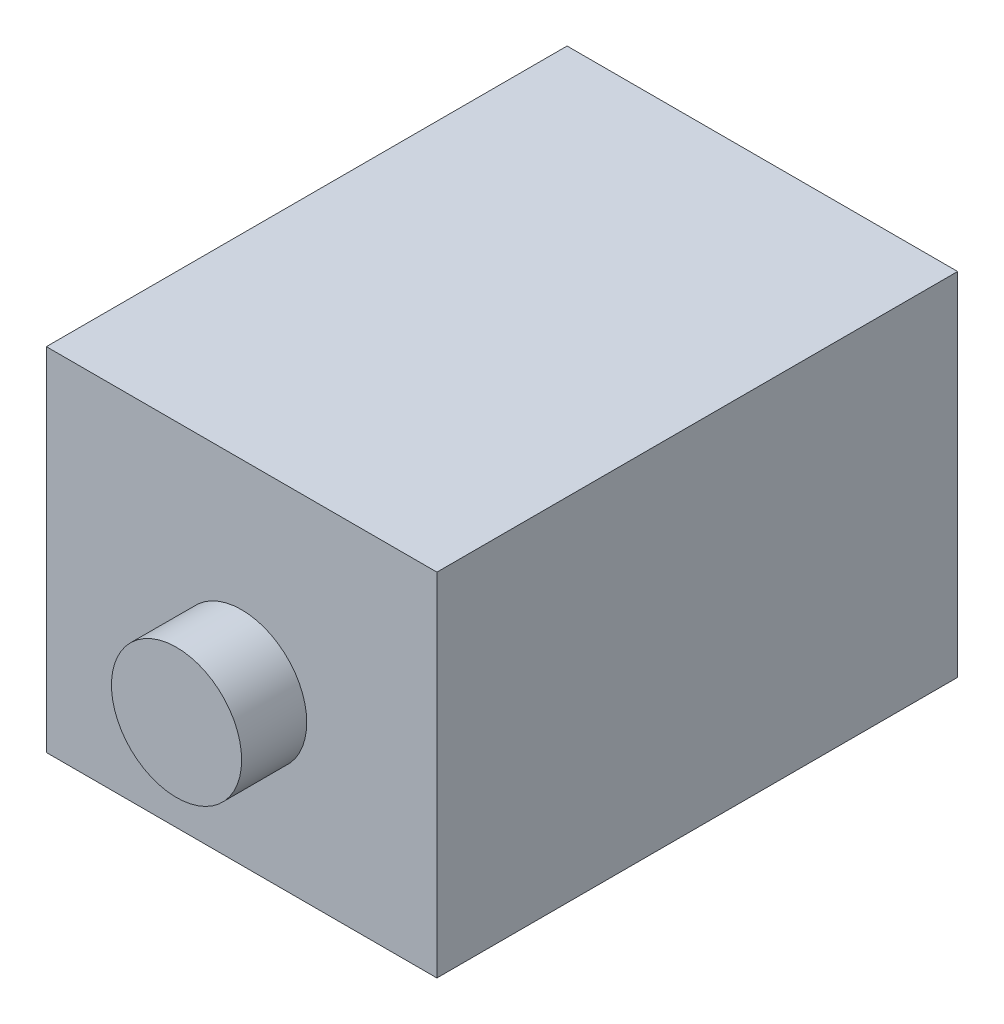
SolidWorks part; units mm, degrees
ref_plane "前视基准面" through (0, 0, 0) normal (0, 0, 1) x (1, 0, 0)
ref_plane "上视基准面" through (0, 0, 0) normal (0, 1, 0) x (1, 0, 0)
ref_plane "右视基准面" through (0, 0, 0) normal (1, 0, 0) x (0, 0, -1)
other "Configuration Table"
sketch "草图1" plane through (0, 0, 0) normal (0, 0, 1) x (1, 0, 0)
  line L1 (-15, -15) -> (15, -15)
  line L2 (-15, -15) -> (-15, 15)
  line L3 (-15, 15) -> (15, 15)
  line L4 (15, -15) -> (15, 15)
  line L5 (-15, -15) -> (15, 15) construction
  line L6 (-15, 15) -> (15, -15) construction
  point P0 (0, 0)
  dimension "D1" = 15
extrude "Geared_Motor_Envelope_30x30x40" add sketch "草图1" against normal mid plane 40
sketch "草图2" plane through (0, 0, 0) normal (0, 0, 1) x (1, 0, 0)
  line L1 (-15, -19) -> (15, -19)
  line L2 (-15, -19) -> (-15, -15)
  line L3 (-15, -15) -> (15, -15)
  line L4 (15, -19) -> (15, -15)
  line L5 (-15, -19) -> (15, -15) construction
  line L6 (-15, -15) -> (15, -19) construction
  point P0 (0, -17)
  dimension "D1" = 17
extrude "Motor_Mount_Foot" add sketch "草图2" against normal mid plane 40
sketch "草图3" plane through (0, 0, 0) normal (0, 0, 1) x (1, 0, 0)
  circle A0 centre (0, 0) radius 5
  dimension "D1" = 10
extrude "Coupler_Envelope_D10" add sketch "草图3" against normal mid plane 50
sketch "草图4" plane through (0, 0, 0) normal (0, 0, 1) x (1, 0, 0)
  line L1 (-30, -50) -> (30, -50)
  line L2 (-30, -50) -> (-30, -10)
  line L3 (-30, -10) -> (30, -10)
  line L4 (30, -50) -> (30, -10)
  line L5 (-30, -50) -> (30, -10) construction
  line L6 (-30, -10) -> (30, -50) construction
  point P0 (0, -30)
  dimension "D1" = 30
  dimension "D2" = 10
  dimension "D3" = 30
extrude "Motor_Height_Clearance" cut sketch "草图4" against normal mid plane 100
sketch "草图5" plane through (0, 0, 0) normal (0, 0, 1) x (1, 0, 0)
  line L1 (-15, -12) -> (15, -12)
  line L2 (-15, -12) -> (-15, -10)
  line L3 (-15, -10) -> (15, -10)
  line L4 (15, -12) -> (15, -10)
  line L5 (-15, -12) -> (15, -10) construction
  line L6 (-15, -10) -> (15, -12) construction
  point P0 (0, -11)
  dimension "D1" = 11
extrude "Motor_Foot_Yminus12" add sketch "草图5" against normal mid plane 40
sketch "草图6" plane through (0, 0, 0) normal (0, 0, 1) x (1, 0, 0)
  line L1 (-50, -50) -> (50, -50)
  line L2 (-50, -50) -> (-50, 50)
  line L3 (-50, 50) -> (50, 50)
  line L4 (50, -50) -> (50, 50)
  line L5 (-50, -50) -> (50, 50) construction
  line L6 (-50, 50) -> (50, -50) construction
  point P0 (0, 0)
  dimension "D1" = 50
extrude "Trim_Back_Shaft_At_Zminus20" cut sketch "草图6" against normal blind 100 from offset 20
